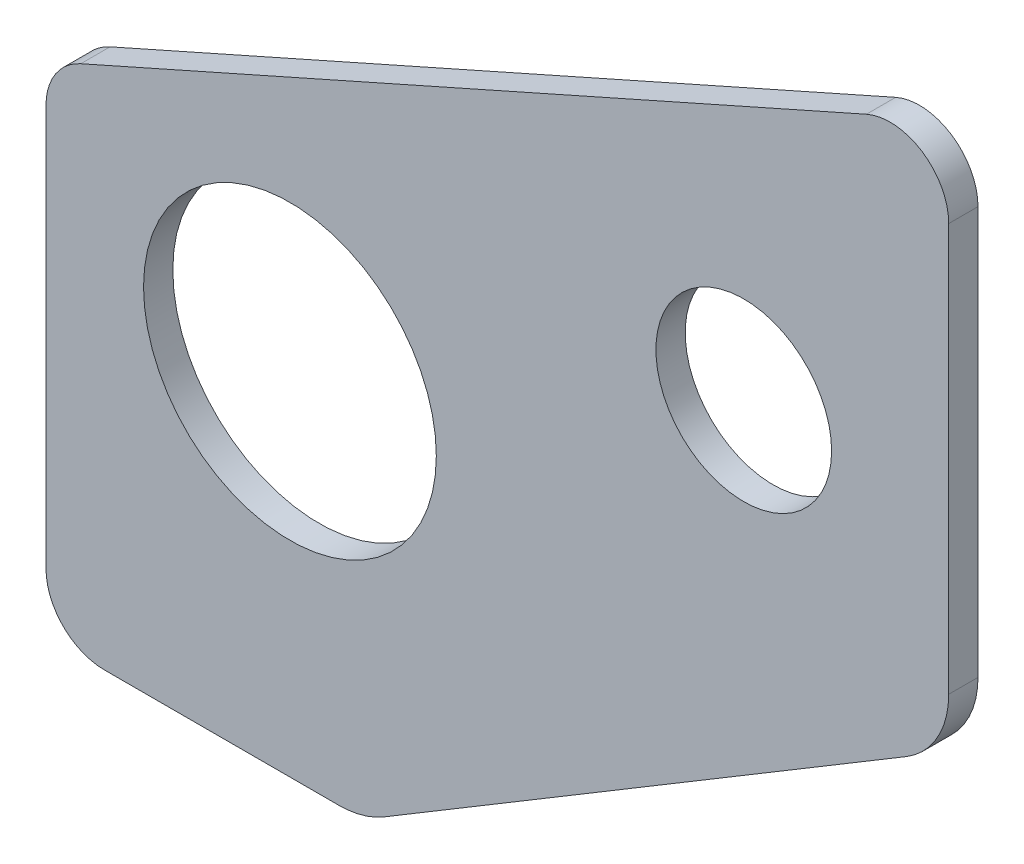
SolidWorks part; units mm, degrees
ref_plane "Face" through (0, 0, 0) normal (0, 0, 1) x (1, 0, 0)
ref_plane "Dessus" through (0, 0, 0) normal (0, 1, 0) x (1, 0, 0)
ref_plane "Droite" through (0, 0, 0) normal (1, 0, 0) x (0, 0, -1)
sketch "Esquisse1" plane through (0, 0, 0) normal (0, 0, 1) x (1, 0, 0)
  line L0 (13.5727, 60.6939) -> (-13.2583, 48.7726)
  line L1 (-13.2583, 48.7726) -> (13.5727, 60.6939) construction
  line L2 (16.3848, 58.8662) -> (16.3848, 44.9433)
  line L3 (14.9282, 42.3708) -> (-2.9027, 31.6723)
  line L4 (14.9282, 42.3708) -> (-2.9027, 31.6723) construction
  line L6 (-4.4462, 31.2447) -> (-12.4462, 31.2447)
  line L7 (-14.4462, 33.2447) -> (-14.4462, 46.9448)
  circle A0 centre (9.3848, 50.1395) radius 3
  circle A2 centre (-6.1152, 43.2447) radius 5
  circle A3 centre (-6.1152, 43.2447) radius 5 construction
  circle A4 centre (9.3848, 50.1395) radius 3 construction
  arc A5 (13.5727, 60.6939) -> (16.3848, 58.8662) centre (14.3848, 58.8662) cw
  arc A12 (16.3848, 58.8662) -> (13.5727, 60.6939) centre (14.3848, 58.8662) ccw construction
  arc A13 (16.3848, 44.9433) -> (14.9282, 42.3708) centre (13.3848, 44.9433) cw
  arc A14 (14.9282, 42.3708) -> (16.3848, 44.9433) centre (13.3848, 44.9433) ccw construction
  arc A15 (-2.9027, 31.6723) -> (-4.4462, 31.2447) centre (-4.4462, 34.2447) cw
  arc A16 (-4.4462, 31.2447) -> (-2.9027, 31.6723) centre (-4.4462, 34.2447) ccw construction
  arc A17 (-12.4462, 31.2447) -> (-14.4462, 33.2447) centre (-12.4462, 33.2447) cw
  arc A18 (-14.4462, 33.2447) -> (-12.4462, 31.2447) centre (-12.4462, 33.2447) ccw construction
  arc A19 (-13.2583, 48.7726) -> (-14.4462, 46.9448) centre (-12.4462, 46.9448) ccw
  arc A20 (-13.2583, 48.7726) -> (-14.4462, 46.9448) centre (-12.4462, 46.9448) ccw construction
extrude "Extrusion1" add sketch "Esquisse1" against normal blind 1
